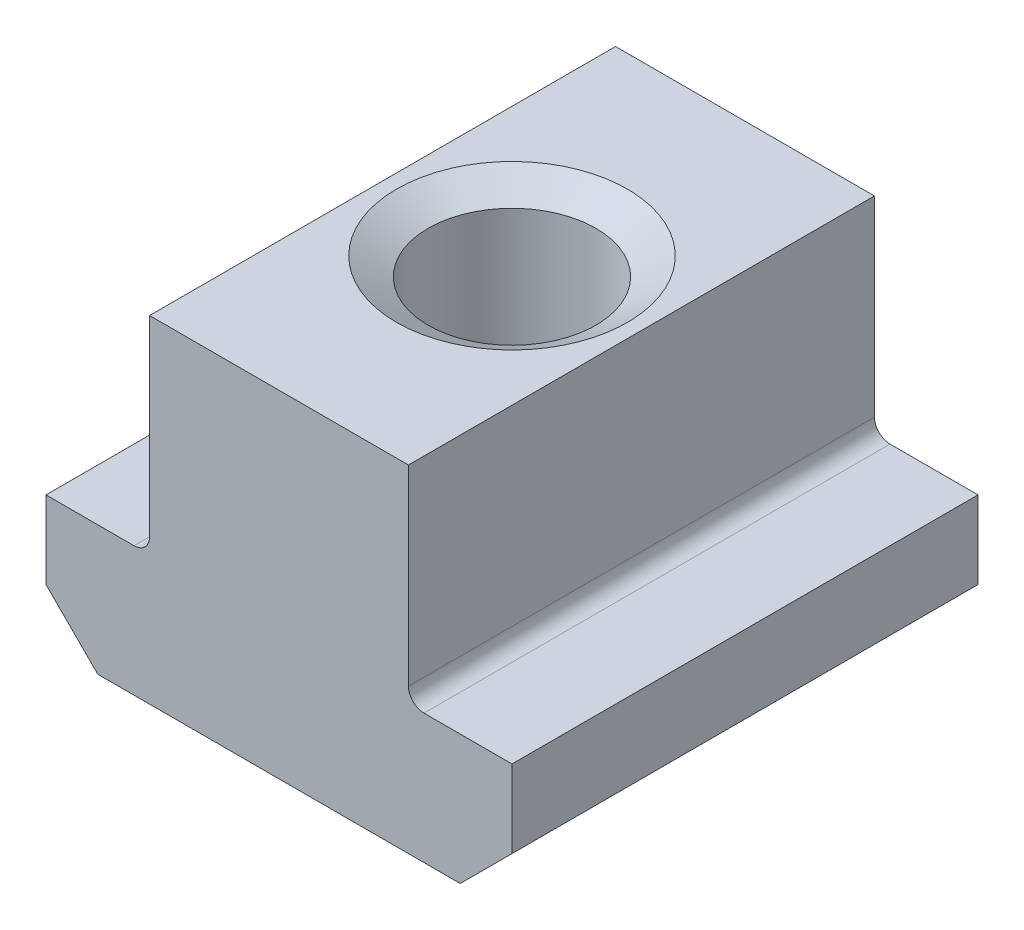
SolidWorks part; units mm, degrees
ref_plane "Plane1" through (0, 0, 0) normal (0, 0, 1) x (1, 0, 0)
ref_plane "Plane2" through (0, 0, 0) normal (0, 1, 0) x (1, 0, 0)
ref_plane "Plane3" through (0, 0, 0) normal (1, 0, 0) x (0, 0, -1)
sketch "BaseNutSke" plane through (0, 0, 0) normal (0, 0, 1) x (1, 0, 0)
  line L0 (2.8, 2.5) -> (4.5, 2.5)
  line L1 (-4.5, 0) -> (4.5, 0)
  line L2 (-4.5, 0) -> (-4.5, 2.5)
  line L3 (-4.5, 2.5) -> (-2.8, 2.5)
  line L4 (4.5, 0) -> (4.5, 2.5)
  line L6 (-2.5, 2.8) -> (-2.5, 6.5)
  line L7 (-2.5, 6.5) -> (2.5, 6.5)
  line L8 (2.5, 2.8) -> (2.5, 6.5)
  arc A0 (2.5, 2.8) -> (2.8, 2.5) centre (2.8, 2.8) ccw
  arc A1 (-2.5, 2.8) -> (-2.8, 2.5) centre (-2.8, 2.8) cw
  point P11 (2.5, 2.5)
  dimension "Corner_radius" = 0.3
  dimension "D1" = 4.5
  dimension "Width" = 9
  dimension "Height" = 2.5
  dimension "Thickness" = 6.5
  dimension "Tongue_width" = 5
  dimension "D2" = 2
extrude "BaseNut" add sketch "BaseNutSke" against normal blind 9
chamfer "Chamfers" distance 1 2 edges at (4.5, 0, -4.5) (-4.5, 0, -4.5)
sketch "HoleSke" plane through (0, 6.5, 0) normal (0, 1, 0) x (-1, 0, 0)
  line L1 (-2.5, 0) -> (2.5, 0) construction
  line L2 (0, -9) -> (0, 0) construction
  line L3 (-2.5, -9) -> (2.5, -9) construction
  circle A0 centre (0, -4.5) radius 1.621
  dimension "Thread_min" = 3.242
  dimension "D2" = 4.5
extrude "TappedHole" cut sketch "HoleSke" against normal through all
chamfer "Chamfer1" distance 0.3516 angle 60 2 edges at (-1.621, 6.5, -4.5) (-1.621, 0, -4.5)
sketch "ThdSchSke" plane through (0, 0, 0) normal (1, 0, 0) x (0, 0, -1)
  line L0 (6.5, 0.2654) -> (6.121, 0.5308)
  line L1 (6.121, 0.5308) -> (4.5, 0.5308)
  line L2 (4.5, 0.5308) -> (4.5, 0)
  line L3 (4.5, 0) -> (6.121, 0)
  line L4 (6.121, 0) -> (6.5, 0.2654)
  line L5 (9, 6.5) -> (0, 6.5) construction
  line L6 (4.5, 47.625) -> (4.5, 6.5) construction
  line L7 (9, 0) -> (0, 0) construction
  line L8 (9, 0) -> (0, 0) construction
  dimension "D2" = 3.242
  dimension "D3" = 70
  dimension "ThreadN" = 4
revolve "ThreadSchematic" [suppressed] cut sketch "ThdSchSke" angle 360 about L6
pattern_linear "ThdSchPat" [suppressed]
equation "\"D1@BaseNutSke\" = \"Width@BaseNutSke\" / 2"
equation "\"D2@BaseNutSke\" =  ( \"Width@BaseNutSke\" - \"Tongue_width@BaseNutSke\" )  / 2"
equation "\"Length@BaseNut\" = \"Width@BaseNutSke\""
equation "\"D2@HoleSke\" = \"Length@BaseNut\" / 2"
equation "\"D1@Chamfer1\" = (\"Tongue_width@BaseNutSke\"-\"Thread_min@HoleSke\")/5"
equation "\"D2@ThdSchSke\" = \"Thread_min@HoleSke\""
equation "\"ThreadN@ThdSchSke\" = \"Thread_nominal@ThreadCosmetic\""
equation "\"Num_threads@ThdSchPat\" =  int( \"Thickness@BaseNutSke\" / \"Advance@ThdSchPat\" ) +1"
